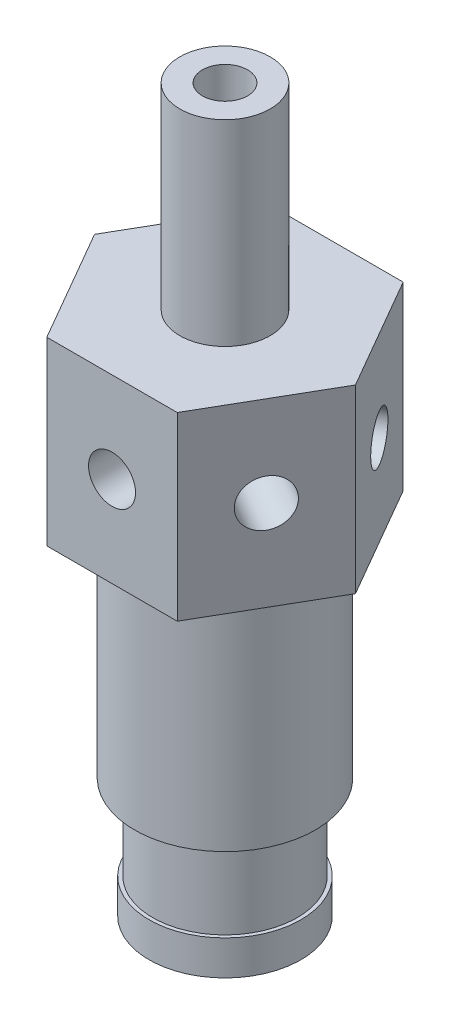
SolidWorks part; units mm, degrees
ref_plane "Front Plane" through (0, 0, 0) normal (0, 0, 1) x (1, 0, 0)
ref_plane "Top Plane" through (0, 0, 0) normal (0, 1, 0) x (1, 0, 0)
ref_plane "Right Plane" through (0, 0, 0) normal (1, 0, 0) x (0, 0, -1)
sketch "Sketch1" plane through (0, 0, 0) normal (0, 0, 1) x (1, 0, 0)
  line L0 (0, 0) -> (0, 71.6346) construction
  line L1 (-0.7937, 0) -> (-1.5875, 0)
  line L2 (-1.5875, 0) -> (-1.5875, 0.0508)
  line L3 (-2.54, 4) -> (-2.667, 4)
  line L4 (-3.175, 4.254) -> (-3.175, 12.15)
  line L5 (-3.175, 12.15) -> (-4.7625, 12.15)
  line L6 (-4.7625, 12.15) -> (-4.7625, 18.5)
  line L7 (-4.7625, 18.5) -> (-1.5875, 18.5)
  line L8 (-1.5875, 0.0508) -> (-2.667, 0.0508)
  line L9 (-1.5875, 18.5) -> (-1.5875, 25.4)
  line L10 (-2.667, 0.0508) -> (-2.667, 1.27)
  line L11 (-2.54, 1.27) -> (-2.54, 4)
  line L12 (-2.54, 1.27) -> (-2.667, 1.27)
  line L13 (-1.5875, 25.4) -> (-0.7937, 25.4)
  line L14 (-0.7937, 25.4) -> (-0.7937, 0)
  line L15 (-3.175, 4.254) -> (-2.667, 4.254)
  line L16 (-2.667, 4.254) -> (-2.667, 4)
  dimension "D1" = 6.35
  dimension "D2" = 5.08
  dimension "D3" = 9.525
  dimension "D4" = 6.35
  dimension "D5" = 4
  dimension "D6" = 18.5
  dimension "D7" = 1.5875
  dimension "D8" = 1.27
  dimension "D9" = 5.334
  dimension "D10" = 3.175
  dimension "D11" = 3.175
  dimension "D12" = 0.0508
  dimension "D13" = 25.4
  dimension "D14" = 0.254
  dimension "D15" = 5.334
revolve "Revolve1" add sketch "Sketch1" angle 360 about L0
sketch "Sketch2" plane through (0, 18.5, 0) normal (0, 1, 0) x (1, 0, 0)
  line L1 (4.5827, 0) -> (2.2914, 3.9688)
  line L2 (2.2914, 3.9688) -> (-2.2914, 3.9688)
  line L3 (-2.2914, 3.9688) -> (-4.5827, 0)
  line L4 (-4.5827, 0) -> (-2.2914, -3.9687)
  line L5 (-2.2914, -3.9687) -> (2.2914, -3.9687)
  line L6 (2.2914, -3.9687) -> (4.5827, 0)
  circle A0 centre (0, 0) radius 3.9687 construction
  dimension "D1" = 7.9375
extrude "Cut-Extrude1" cut sketch "Sketch2" against normal through all flip side to cut
sketch "Sketch3" plane through (3.437, 0, -1.9844) normal (0.866, 0, -0.5) x (-0.5, 0, -0.866)
  line L0 (0, 18.5) -> (0, 15.325) construction
  line L1 (-2.2914, 18.5) -> (2.2914, 18.5) construction
  line L2 (0, 15.325) -> (-2.2914, 15.325) construction
  line L3 (-2.2914, 12.15) -> (-2.2914, 18.5) construction
  circle A0 centre (0, 15.325) radius 0.8255
  dimension "D1" = 1.651
extrude "Cut-Extrude2" cut sketch "Sketch3" against normal up to surface (2.6128 mm away)
pattern_circular "CirPattern1" count 6 over 360 about axis through (0, 0, 0) along (0, -1, 0) of "Cut-Extrude2"
